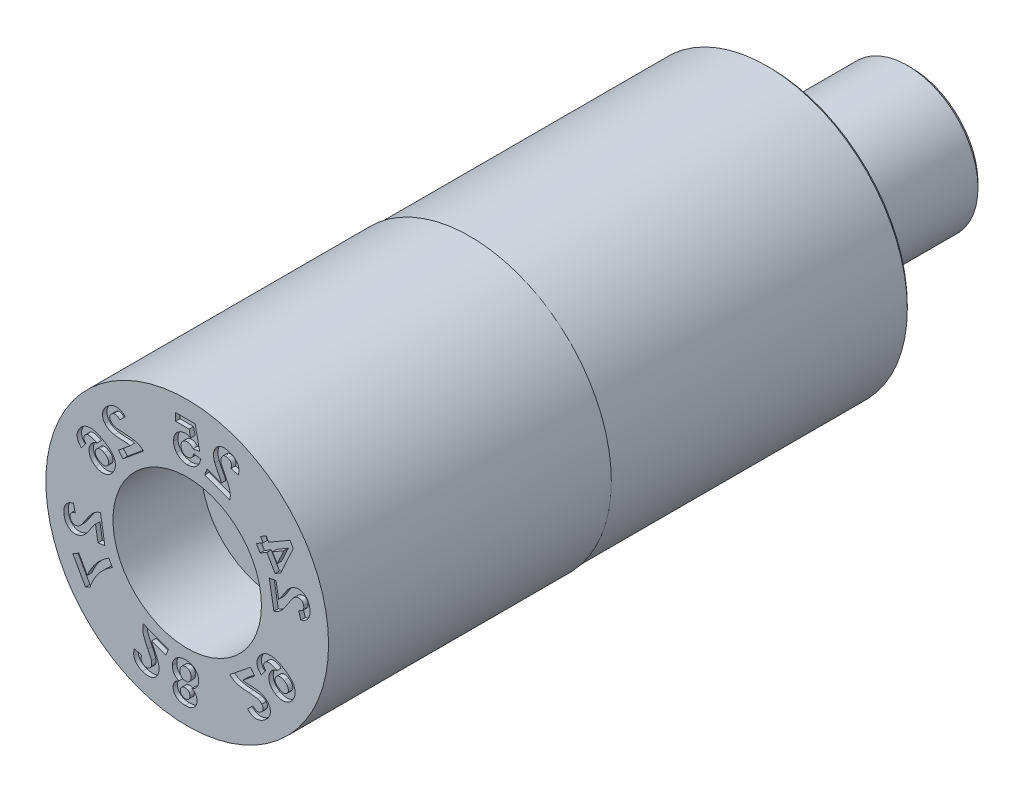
SolidWorks part; units mm, degrees
other "<M8 X 1.25 SHSS>-<Revolve1>"
ref_plane "Front Plane" through (0, 0, 0) normal (0, 0, 1) x (1, 0, 0)
ref_plane "Top Plane" through (0, 0, 0) normal (0, 1, 0) x (1, 0, 0)
ref_plane "Right Plane" through (0, 0, 0) normal (1, 0, 0) x (0, 0, -1)
sketch "Sketch1" plane through (0, 0, 0) normal (1, 0, 0) x (0, 0, -1)
  line L2 (0, 8) -> (0, 4.2)
  line L3 (32.75, 8) -> (0, 8)
  line L4 (-3.7979, 0) -> (49996.2021, 0) construction
  line L8 (25, 1.75) -> (5, 1.75)
  line L9 (5, 4.2) -> (5, 1.75)
  line L10 (5, 4.2) -> (0, 4.2)
  line L12 (33, 4) -> (33, 7.75)
  line L16 (33, 7.75) -> (32.75, 8)
  line L17 (33, 4) -> (25, 4)
  line L18 (25, 1.75) -> (25, 4)
  dimension "D1" = 33
  dimension "D2" = 45
  dimension "D3" = 0.25
  dimension "D4" = 16
  dimension "D5" = 8.4
  dimension "D6" = 5
  dimension "D7" = 3.5
  dimension "D8" = 8
  dimension "D9" = 8
revolve "Revolve1" add sketch "Sketch1" angle 360 about L4
sketch "Sketch4" plane through (0, 0, 0) normal (1, 0, 0) x (0, 0, -1)
  line L0 (0, 0) -> (50000, 0) construction
  line L1 (33, -7.75) -> (33, 7.75) construction
  line L2 (16, 8.935) -> (33, 8.935)
  line L3 (16, 8.935) -> (16, 7.935)
  line L4 (16, 7.935) -> (33, 7.935)
  line L5 (33, 8.935) -> (33, 7.935)
  line L6 (32.75, 8) -> (0, 8) construction
  line L9 (0, 8.8) -> (0, -8.8) construction
  dimension "D1" = 1
  dimension "D2" = 0.065
  dimension "D3" = 16
revolve "Cut-Revolve1" cut sketch "Sketch4" angle 360 about L0
sketch "Sketch2" plane through (0, 0, 0) normal (0, 0, 1) x (1, 0, 0)
  line L0 (0, 0) -> (0, 10.0042) construction
  line L1 (0, 0) -> (8.6639, 5.0021) construction
  line L2 (0, 0) -> (8.6639, -5.0021) construction
  line L3 (0, 0) -> (0, -10.0042) construction
  line L4 (0, 0) -> (-8.6639, -5.0021) construction
  line L5 (0, 0) -> (-8.6639, 5.0021) construction
  circle A0 centre (0, 0) radius 4.9201 construction
  text T0 "24  25  26  27  28  29" font "Arial" height 2.22
  point P11 (0, 0)
  point P1959 (0, 0.0125)
  point P1960 (0.0125, 0.0125)
  point P1961 (0.0125, 0)
  dimension "D1" = 6
extrude "Cut-Extrude1" cut sketch "Sketch2" against normal blind 0.25
sketch "Sketch3" plane through (0, 0, -5) normal (0, 0, 1) x (1, 0, 0)
  line L0 (0, 0) -> (0, 50000) construction
  line L1 (1.0104, 1.75) -> (-1.0104, 1.75)
  line L2 (-1.0104, 1.75) -> (-2.0207, 0)
  line L3 (-2.0207, 0) -> (-1.0104, -1.75)
  line L4 (-1.0104, -1.75) -> (1.0104, -1.75)
  line L5 (1.0104, -1.75) -> (2.0207, 0)
  line L6 (2.0207, 0) -> (1.0104, 1.75)
  line L7 (0, 0) -> (50000, 0) construction
  circle A0 centre (0, 0) radius 1.75 construction
  circle A1 centre (0, 0) radius 1.75 construction
extrude "Cut-Extrude2" cut sketch "Sketch3" against normal blind 4
inserted part "M8 X 1.25 SHSS"
move or copy body "Body-Move/Copy2" placed by mates yes
